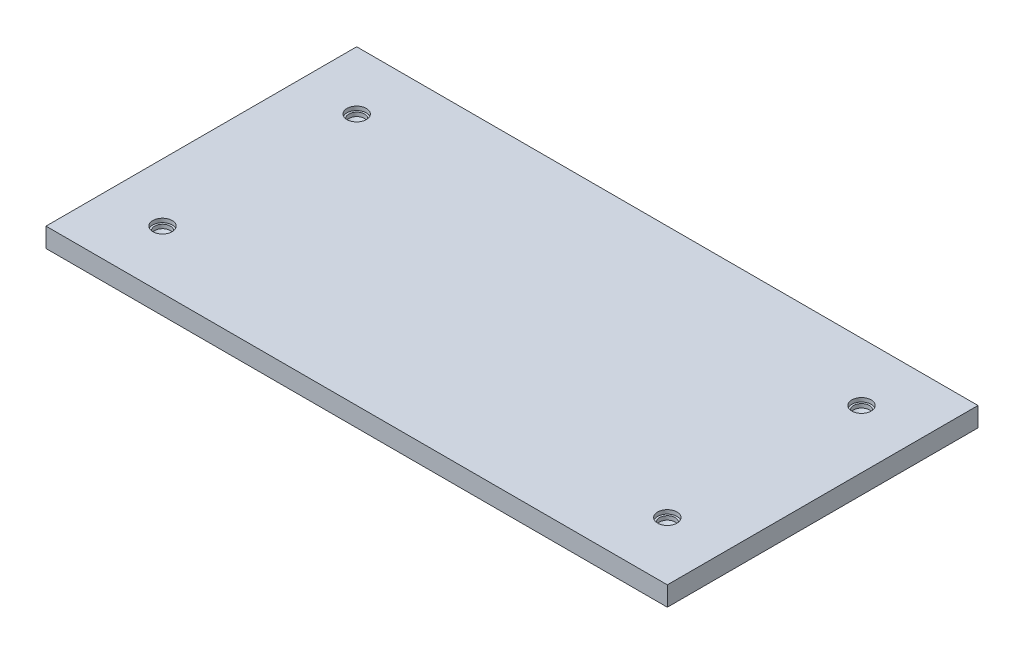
SolidWorks part; units mm, degrees
ref_plane "Front Plane" through (0, 0, 0) normal (0, 0, 1) x (1, 0, 0)
ref_plane "Top Plane" through (0, 0, 0) normal (0, 1, 0) x (1, 0, 0)
ref_plane "Right Plane" through (0, 0, 0) normal (1, 0, 0) x (0, 0, -1)
sketch "Sketch1" plane through (0, 0, 0) normal (0, 1, 0) x (1, 0, 0)
  line L1 (-101.6, -50.8) -> (101.6, -50.8)
  line L2 (-101.6, -50.8) -> (-101.6, 50.8)
  line L3 (-101.6, 50.8) -> (101.6, 50.8)
  line L4 (101.6, -50.8) -> (101.6, 50.8)
  line L5 (-101.6, -50.8) -> (101.6, 50.8) construction
  line L6 (-101.6, 50.8) -> (101.6, -50.8) construction
  point P0 (0, 0)
  dimension "D1" = 203.2
  dimension "D2" = 101.6
extrude "Boss-Extrude1" add sketch "Sketch1" along normal blind 6.35
sketch "Sketch2" plane through (0, 6.35, 0) normal (0, 1, 0) x (1, 0, 0)
  line L0 (-82.55, -50.8) -> (-82.55, 50.8) construction
  line L1 (-101.6, -50.8) -> (101.6, -50.8) construction
  line L2 (101.6, 50.8) -> (-101.6, 50.8) construction
  line L3 (-101.6, 31.75) -> (101.6, 31.75) construction
  line L4 (-101.6, 50.8) -> (-101.6, -50.8) construction
  line L5 (101.6, -50.8) -> (101.6, 50.8) construction
  dimension "D1" = 19.05
  dimension "D2" = 19.05
hole_wizard "1/4-20 Tapped Hole1" positions "Sketch5" profile "Sketch3" tap size "1/4-20" standard "ANSI Inch"
sketch "Sketch5" plane through (0, 6.35, 0) normal (0, 1, 0) x (1, 0, 0)
  line L0 (-82.55, -50.8) -> (-82.55, 50.8) construction
  line L1 (-101.6, 31.75) -> (101.6, 31.75) construction
  point P0 (-82.55, 31.75)
sketch "Sketch3" plane through (-82.55, 6.35, -31.75) normal (1, 0, 0) x (0, 0, 1)
  line L0 (0, 0) -> (0, 4.0738)
  line L1 (0, 4.0738) -> (2.5527, 2.54)
  line L2 (2.5527, 2.54) -> (2.5527, 1.27)
  line L3 (2.5527, 1.27) -> (3.175, 1.27)
  line L4 (3.175, 1.27) -> (3.175, 0)
  line L5 (3.175, 0) -> (0, 0)
  line L10 (0, 4.0738) -> (-2.5527, 2.54) construction
  line L11 (0, -6.35) -> (0, 107.95) construction
  dimension "Tap Drill Dia." = 5.1054
  dimension "Tap Drill Depth" = 2.54
  dimension "Thread Major Dia." = 6.35
  dimension "Thread Depth" = 1.27
  dimension "Drill Angle" = 118
mirror "Mirror1" about plane through (0, 0, 0) normal (1, 0, 0) of "1/4-20 Tapped Hole1"
mirror "Mirror2" about plane through (0, 0, 0) normal (0, 0, 1) of "Mirror1", "1/4-20 Tapped Hole1"
